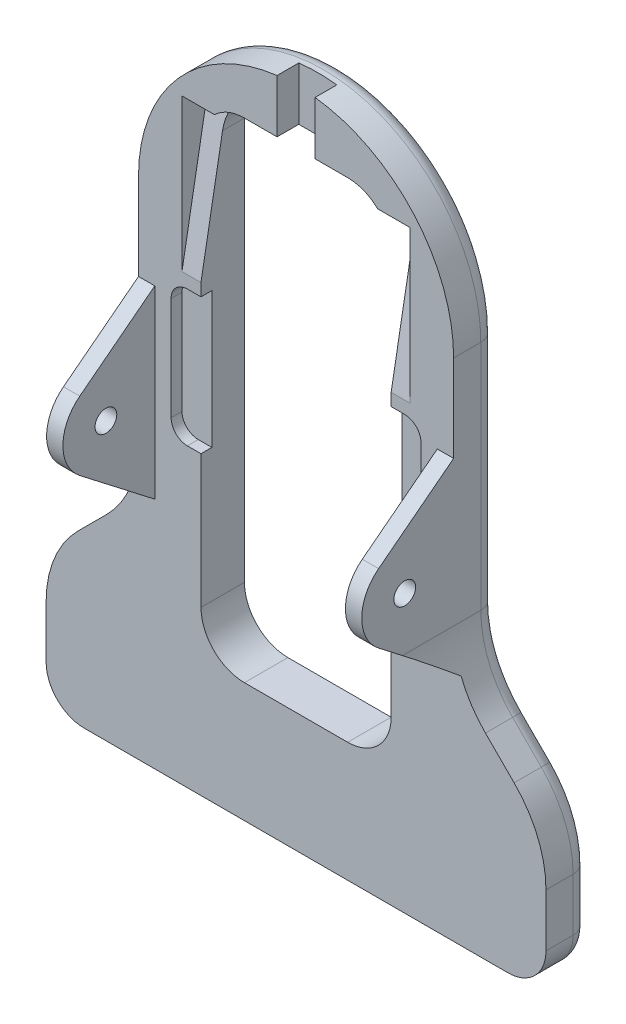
SolidWorks part; units mm, degrees
ref_plane "Спереди" through (0, 0, 0) normal (0, 0, 1) x (1, 0, 0)
ref_plane "Сверху" through (0, 0, 0) normal (0, 1, 0) x (1, 0, 0)
ref_plane "Справа" through (0, 0, 0) normal (1, 0, 0) x (0, 0, -1)
sketch "Эскиз1" plane through (0, 0, 0) normal (0, 0, 1) x (1, 0, 0)
  line L0 (0, -17.5691) -> (0, 131.0298) construction
  line L1 (46, 0) -> (-46, 0)
  line L2 (-46, 0) -> (-46, 25)
  line L3 (-46, 25) -> (-29, 42)
  line L4 (-29, 42) -> (-29, 93)
  line L6 (29, 42) -> (29, 93)
  line L7 (46, 25) -> (29, 42)
  line L8 (46, 0) -> (46, 25)
  arc A0 (-29, 93) -> (29, 93) centre (0, 93) cw
  point P3 (0, 122)
  point P17 (0, 0)
  dimension "D1" = 58
  dimension "D2" = 122
  dimension "D3" = 92
  dimension "D4" = 42
  dimension "D5" = 25
extrude "Бобышка-Вытянуть1" add sketch "Эскиз1" along normal blind 8
sketch "Эскиз2" plane through (0, 0, 0) normal (1, 0, 0) x (0, 0, -1)
  line L0 (28.2333, 60) -> (-74.9181, 60) construction
  line L2 (-30, 60) -> (-8, 77)
  line L3 (-8, 42) -> (-8, 93) construction
  line L4 (-8, 77) -> (-8, 43)
  line L5 (-8, 43) -> (-30, 60)
  dimension "D1" = 60
  dimension "D2" = 34
  dimension "D3" = 22
extrude "Бобышка-Вытянуть2" add sketch "Эскиз2" along normal mid plane 58
sketch "Эскиз3" plane through (0, 0, 0) normal (0, -1, 0) x (1, 0, 0)
  line L0 (29, 8) -> (-29, 8) construction
  line L1 (-26, 8) -> (26, 8)
  line L2 (-26, 8) -> (-26, 30)
  line L3 (-26, 30) -> (26, 30)
  line L4 (26, 8) -> (26, 30)
  line L5 (29, 30) -> (-29, 30) construction
  line L6 (0, 0) -> (0, 30) construction
  line L7 (29, 30) -> (29, 8) construction
  point P11 (0, 30)
  dimension "D1" = 3
extrude "Вырез-Вытянуть1" cut sketch "Эскиз3" against normal through all
sketch "Эскиз4" plane through (29, 0, 0) normal (1, 0, 0) x (0, 0, -1)
  line L0 (-30, 60) -> (0, 60) construction
  line L2 (0, 42) -> (0, 93) construction
  circle A0 centre (-17, 60) radius 2
  dimension "D1" = 17
  dimension "D2" = 4
extrude "Вырез-Вытянуть2" cut sketch "Эскиз4" against normal up to surface (58 mm away)
sketch "Эскиз5" plane through (0, 0, 8) normal (0, 0, 1) x (1, 0, 0)
  line L0 (0, 0) -> (0, 122) construction
  line L2 (-9.5, 112) -> (9.5, 112)
  line L3 (-17.5, 104) -> (-17.5, 30)
  line L4 (-9.5, 22) -> (9.5, 22)
  line L5 (17.5, 104) -> (17.5, 30)
  arc A0 (29, 93) -> (-29, 93) centre (0, 93) ccw construction
  arc A1 (9.5, 22) -> (17.5, 30) centre (9.5, 30) ccw
  arc A2 (-17.5, 30) -> (-9.5, 22) centre (-9.5, 30) ccw
  arc A3 (9.5, 112) -> (17.5, 104) centre (9.5, 104) cw
  arc A4 (-9.5, 112) -> (-17.5, 104) centre (-9.5, 104) ccw
  point P10 (0, 112)
  point P17 (17.5, 112)
  point P20 (-17.5, 112)
  dimension "D4" = 8
  dimension "D1" = 35
  dimension "D2" = 90
  dimension "D3" = 10
extrude "Вырез-Вытянуть3" cut sketch "Эскиз5" against normal through all
sketch "Эскиз6" plane through (0, 0, 8) normal (0, 0, 1) x (1, 0, 0)
  line L0 (-23, 67) -> (23, 67) construction
  line L1 (-20, 79.5) -> (20, 79.5)
  line L2 (-23, 76.5) -> (-23, 57.5)
  line L3 (-20, 54.5) -> (20, 54.5)
  line L4 (23, 76.5) -> (23, 57.5)
  line L5 (-17.5, 104) -> (-17.5, 30) construction
  line L6 (0, 112) -> (0, 22) construction
  line L7 (9.5, 112) -> (-9.5, 112) construction
  line L8 (-9.5, 22) -> (9.5, 22) construction
  arc A0 (-23, 57.5) -> (-20, 54.5) centre (-20, 57.5) ccw
  arc A1 (20, 54.5) -> (23, 57.5) centre (20, 57.5) ccw
  arc A2 (20, 79.5) -> (23, 76.5) centre (20, 76.5) cw
  arc A3 (-20, 79.5) -> (-23, 76.5) centre (-20, 76.5) ccw
  point P8 (-17.5, 67)
  point P15 (0, 79.5)
  dimension "D3" = 3
  dimension "D1" = 25
  dimension "D2" = 46
extrude "Вырез-Вытянуть4" cut sketch "Эскиз6" against normal blind 2
fillet "Скругление1" radius 20 4 edges at (46, 25, 4) (-46, 25, 4) (-29, 42, 4) (29, 42, 4)
fillet "Скругление2" radius 7 2 edges at (-46, 0, 4) (46, 0, 4)
fillet "Скругление3" radius 8 2 edges at (-27.5, 60, 30) (27.5, 60, 30)
sketch "Эскиз7" plane through (0, 0, 8) normal (0, 0, 1) x (1, 0, 0)
  line L0 (0, 122) -> (0, 112) construction
  line L1 (9.5, 112) -> (-9.5, 112) construction
  line L3 (-3.5, 122) -> (3.5, 122)
  line L4 (-3.5, 122) -> (-3.5, 112)
  line L5 (-3.5, 112) -> (3.5, 112)
  line L6 (3.5, 122) -> (3.5, 112)
  arc A0 (29, 93) -> (-29, 93) centre (0, 93) ccw construction
  point P11 (0, 112)
  point P12 (0, 122)
  dimension "D1" = 7
extrude "Вырез-Вытянуть5" cut sketch "Эскиз7" against normal blind 4
fillet "Скругление4" radius 3 14 edges at (30.5224, 42.6306, 0) (37.5, 33.5, 0) (44.4776, 24.3694, 0) (46, 11.8579, 0) (43.9497, 2.0503, 0) (0, 0, 0) (-43.9497, 2.0503, 0) (-46, 11.8579, 0) (-44.4776, 24.3694, 0) (-37.5, 33.5, 0) (-30.5224, 42.6306, 0) (-29, 71.6421, 0) (0, 122, 0) (29, 71.6421, 0)
sketch "Эскиз9" plane through (0, 0, 0) normal (1, 0, 0) x (0, 0, -1)
  line L0 (-8, 81.788) -> (-8, 109.788)
  line L1 (-8, 104) -> (-8, 79.5) construction
  line L2 (-8, 109.788) -> (-3, 109.788)
  line L3 (-3, 109.788) -> (-8, 81.788)
  dimension "D1" = 12
  dimension "D2" = 5
  dimension "D3" = 28
extrude "Вырез-Вытянуть6" cut sketch "Эскиз9" against normal mid plane 42
